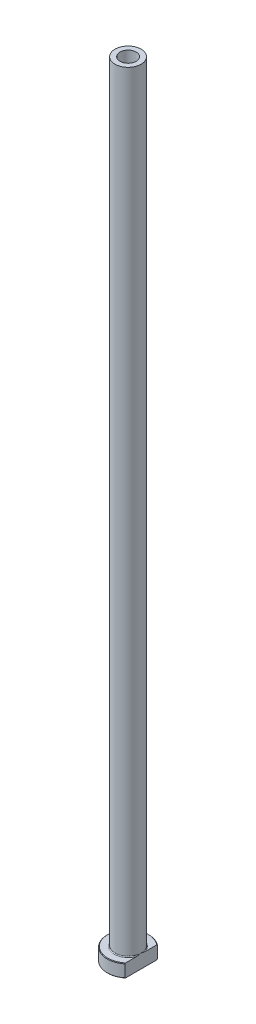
SolidWorks part; units mm, degrees
ref_plane "Front Plane" through (0, 0, 0) normal (0, 0, 1) x (1, 0, 0)
ref_plane "Top Plane" through (0, 0, 0) normal (0, 1, 0) x (1, 0, 0)
ref_plane "Right Plane" through (0, 0, 0) normal (1, 0, 0) x (0, 0, -1)
sketch "Sketch1" plane through (0, 0, 0) normal (0, 0, 1) x (1, 0, 0)
  line L0 (-3.1, 300) -> (-5, 300)
  line L1 (-5, 300) -> (-5, 5)
  line L2 (-5, 5) -> (-8, 5)
  line L3 (-8, 5) -> (-8, 0)
  line L4 (7.15, 0) -> (-7.15, 0) construction
  line L5 (-8, 0) -> (-3.35, 0)
  line L6 (-3.1, 255) -> (-3.1, 300)
  line L7 (0, 92.1877) -> (0, -15.5353) construction
  line L8 (0, -8.8) -> (0, 8.8) construction
  line L9 (-3.1, 255) -> (-3.35, 243)
  line L10 (-3.35, 243) -> (-3.35, 0)
  dimension "D1" = 0.25
  dimension "ID" = 6.2
  dimension "OD" = 10
  dimension "L" = 300
  dimension "H" = 16
  dimension "T" = 5
  dimension "N" = 45
  dimension "D2" = 12
  dimension "L-N" = 255
revolve "Revolve1" add sketch "Sketch1" angle 360 about L7
fillet "Fillet1" radius 0.3 1 edges at (0, 5, 5)
chamfer "Chamfer1" distance 0.2 angle 45 2 edges at (0, 5, 8) (0, 0, 8)
sketch "Sketch2" plane through (0, 0, 0) normal (0, -1, 0) x (1, 0, 0)
  line L0 (5, 6.245) -> (5, -6.245)
  circle A0 centre (0, 0) radius 8 construction
  arc A1 (5, 6.245) -> (5, -6.245) centre (0, 0) cw
  circle A2 centre (0, 0) radius 5 construction
extrude "Cut-Extrude1" cut sketch "Sketch2" against normal through all
chamfer "Chamfer2" distance 0.5 angle 45 1 edges at (0, 0, 3.35)
